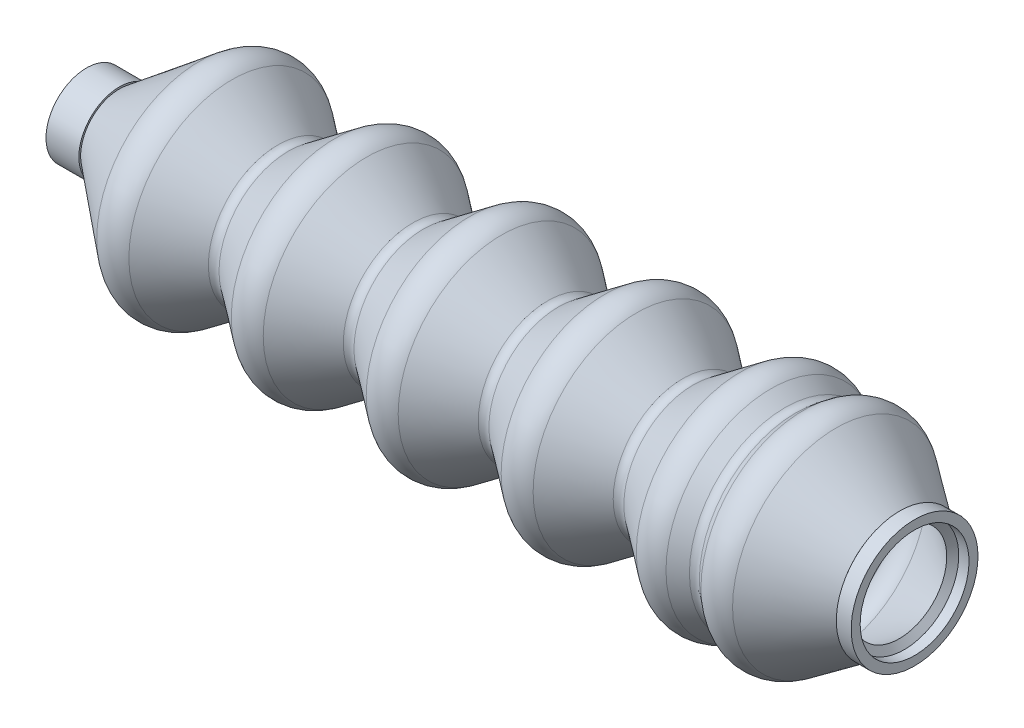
SolidWorks part; units mm, degrees
ref_plane "Plan1" through (0, 0, 0) normal (0, 0, 1) x (1, 0, 0)
ref_plane "Plan2" through (0, 0, 0) normal (0, 1, 0) x (1, 0, 0)
ref_plane "Plan3" through (0, 0, 0) normal (1, 0, 0) x (0, 0, -1)
sketch "Esquisse1" plane through (0, 0, 0) normal (0, 0, 1) x (1, 0, 0)
  line L119 (237.7631, 40.4668) -> (249.5438, 31.764)
  line L120 (249.5438, 31.764) -> (256.973, 36.646)
  line L121 (256.973, 36.646) -> (264.4023, 31.1272)
  line L122 (264.4023, 31.1272) -> (272.0438, 36.646)
  line L123 (272.0438, 36.646) -> (279.1547, 31.1272)
  line L124 (279.1547, 31.1272) -> (286.6901, 36.646)
  line L125 (286.6901, 36.646) -> (293.9071, 31.1272)
  line L126 (293.9071, 31.1272) -> (302.0793, 36.646)
  line L127 (302.0793, 36.646) -> (309.6146, 31.1272)
  line L128 (309.6146, 31.1272) -> (313.4354, 33.6743)
  line L129 (313.4354, 33.6743) -> (316.6194, 31.1272)
  line L130 (316.6194, 31.1272) -> (324.367, 36.646)
  line L131 (324.367, 36.646) -> (325.4617, 37.4258)
  line L132 (325.4617, 37.4258) -> (326.0172, 36.646)
  line L133 (326.0172, 36.646) -> (328.2939, 36.646)
  line L134 (237.7631, 40.4668) -> (237.7631, 39.1932)
  line L135 (237.7631, 39.1932) -> (235.1098, 39.1932)
  line L136 (235.1098, 39.1932) -> (235.1098, 42.6956)
  line L137 (235.1098, 42.6956) -> (331.1595, 42.6956) construction
sketch "Esquisse2" plane through (0, 0, 0) normal (0, 0, 1) x (1, 0, 0)
  line L0 (235.1098, 42.6956) -> (331.1595, 42.6956) construction
  line L1 (235.1098, 42.6956) -> (235.1098, 39.1932)
  line L2 (235.1098, 39.1932) -> (237.7631, 39.1932)
  line L3 (237.7631, 39.1932) -> (237.7631, 40.4668)
  line L4 (237.7631, 40.4668) -> (248.2634, 32.0831)
  line L5 (250.6954, 32.0342) -> (255.7889, 35.7762)
  line L6 (235.1098, 42.6956) -> (327.1556, 42.6956)
  line L8 (263.2889, 32.0061) -> (258.1571, 35.7762)
  line L9 (265.6571, 32.0061) -> (270.7889, 35.7762)
  line L10 (278.2889, 32.0061) -> (273.1571, 35.7762)
  line L11 (280.6571, 32.0061) -> (285.7889, 35.7762)
  line L12 (293.2889, 32.0061) -> (288.1571, 35.7762)
  line L13 (295.6571, 32.0061) -> (300.7889, 35.7762)
  line L14 (308.3752, 31.9428) -> (303.1571, 35.7762)
  line L15 (310.6432, 31.8738) -> (312.2259, 32.8944)
  line L17 (314.5592, 32.7753) -> (315.4399, 32.0708)
  line L19 (317.8496, 32.0035) -> (325.4617, 37.4258)
  line L21 (325.4617, 37.4258) -> (326.0172, 36.646)
  line L23 (326.0172, 36.646) -> (327.1556, 36.646)
  line L24 (326.0172, 36.646) -> (328.2939, 36.646) construction
  line L26 (327.1556, 36.646) -> (327.1556, 42.6956)
  arc A0 (250.6954, 32.0342) -> (248.2634, 32.0831) centre (249.5113, 33.646) cw
  arc A1 (265.6571, 32.0061) -> (263.2889, 32.0061) centre (264.473, 33.618) cw
  arc A2 (258.1571, 35.7762) -> (255.7889, 35.7762) centre (256.973, 34.1644) ccw
  arc A3 (280.6571, 32.0061) -> (278.2889, 32.0061) centre (279.473, 33.618) cw
  arc A4 (273.1571, 35.7762) -> (270.7889, 35.7762) centre (271.973, 34.1644) ccw
  arc A5 (285.7889, 35.7762) -> (288.1571, 35.7762) centre (286.973, 34.1644) cw
  arc A6 (303.1571, 35.7762) -> (300.7889, 35.7762) centre (301.973, 34.1644) ccw
  arc A7 (295.6571, 32.0061) -> (293.2889, 32.0061) centre (294.473, 33.618) cw
  arc A8 (308.3752, 31.9428) -> (310.6432, 31.8738) centre (309.5593, 33.5546) ccw
  arc A9 (312.2259, 32.8944) -> (314.5592, 32.7753) centre (313.3098, 31.2136) cw
  arc A10 (315.4399, 32.0708) -> (317.8496, 32.0035) centre (316.6893, 33.6325) ccw
  point P48 (249.4606, 31.1272)
  point P63 (309.4854, 31.1272)
  point P66 (313.4354, 33.6743)
  dimension "D1" = 2
revolve "Base-Révolution" add sketch "Esquisse2" angle 360 about L0
shell "Coque4" thickness 1
